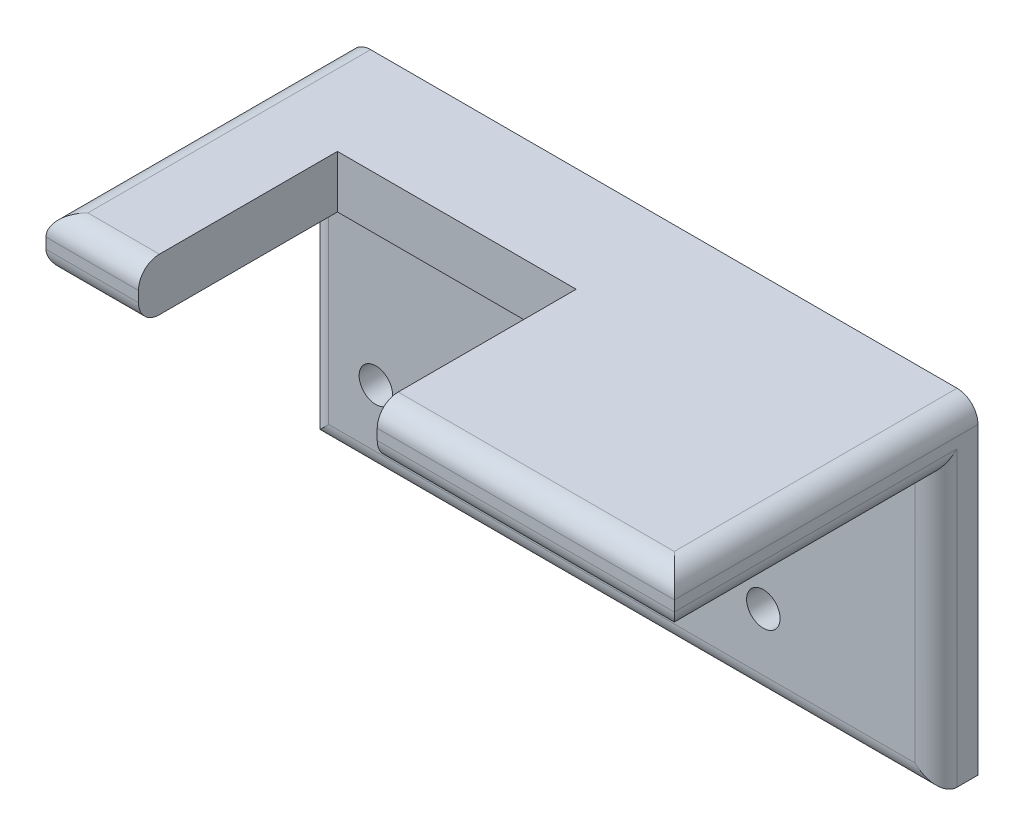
SolidWorks part; units mm, degrees
ref_plane "Plan de face" through (0, 0, 0) normal (0, 0, 1) x (1, 0, 0)
ref_plane "Plan de dessus" through (0, 0, 0) normal (0, 1, 0) x (1, 0, 0)
ref_plane "Plan de droite" through (0, 0, 0) normal (1, 0, 0) x (0, 0, -1)
sketch "Esquisse1" plane through (0, 0, 0) normal (0, 0, 1) x (1, 0, 0)
  line L0 (0, 0) -> (-59156.5526, 0) construction
  line L1 (0, 0) -> (0, 17.747) construction
  line L2 (-18.5, -36.3313) -> (-18.5, 59120.2212) construction
  line L3 (-25, 16) -> (35, 16)
  line L4 (-25, 16) -> (-25, -15)
  line L5 (-25, -15) -> (35, -15)
  line L6 (35, 16) -> (35, -15)
  line L7 (18.5, -63.5241) -> (18.5, 59093.0285) construction
  line L8 (63.747, 7.5) -> (-59092.8056, 7.5) construction
  line L9 (64.8614, -7.5) -> (-59091.6911, -7.5) construction
  line L10 (40.538, 11) -> (-33.8123, 11) construction
  circle A0 centre (-18.5, 7.5) radius 1.6
  circle A1 centre (-18.5, -7.5) radius 1.6
  circle A2 centre (0, 0) radius 1.6
  circle A3 centre (18.5, 7.5) radius 1.6
  circle A4 centre (18.5, -7.5) radius 1.6
  point P27 (0, 0)
  point P30 (0, 0)
  point P31 (0, 0)
  point P32 (0, 0)
  point P33 (0, 0)
  point P34 (0, 0)
  point P35 (0, 0)
  point P36 (0, 0)
  dimension "D5" = 11
  dimension "D1" = 18.5
  dimension "D2" = 18.5
  dimension "D3" = 7.5
  dimension "D4" = 7.5
extrude "Boss.-Extru.1" add sketch "Esquisse1" along normal blind 4
sketch "Esquisse3" plane through (0, 0, 4) normal (0, 0, 1) x (1, 0, 0)
  line L0 (0, -0.0101) -> (-41.5239, -0.0101) construction
  line L1 (0, 0) -> (0, 24.4112) construction
  line L2 (45.6968, 10.9899) -> (-41.1516, 10.9899) construction
  line L4 (-25, 16) -> (35, 16)
  line L5 (-25, 16) -> (-25, 10.9899)
  line L6 (-25, 10.9899) -> (35, 10.9899)
  line L7 (35, 16) -> (35, 10.9899)
  dimension "D1" = 11
extrude "Boss.-Extru.2" add sketch "Esquisse3" along normal blind 25
sketch3d "Esquisse3D1"
  point P0 (1.6736, 16, 8.1619)
ref_plane "SupportServo" through (0, 16, 0) normal (0, 1, 0) x (1, 0, 0)
sketch "Esquisse4" plane through (0, 16, 0) normal (0, 1, 0) x (1, 0, 0)
  line L0 (-18.5207, -35.1822) -> (-18.5207, 3.3258) construction
  line L1 (-0.0207, 0) -> (-0.0207, -36.4943) construction
  line L2 (8.9793, -41.4575) -> (8.9793, 3.8393) construction
  line L4 (-4.7707, -43.1119) -> (-4.7707, -6.943) construction
  line L5 (-16.1707, -34.8969) -> (-16.1707, -13.9029) construction
  line L6 (6.6293, -42.3703) -> (6.6293, -19.2655) construction
  line L7 (45.9036, -10) -> (-52.6197, -10) construction
  line L8 (35, 0) -> (-25, 0) construction
  line L14 (-16.1707, -10) -> (6.6293, -10)
  line L15 (-16.1707, -10) -> (-16.1707, -29)
  line L16 (-16.1707, -29) -> (6.6293, -29)
  line L17 (6.6293, -10) -> (6.6293, -29)
  line L18 (35, -29) -> (-25, -29) construction
  dimension "D1" = 18.5
  dimension "D2" = 27.5
  dimension "D3" = 13.75
  dimension "D4" = 11.4
  dimension "D5" = 11.4
  dimension "D6" = 10
extrude "Enlèv. mat.-Extru.1" cut sketch "Esquisse4" against normal up to next
fillet "Congé1" radius 2 11 edges at (-20.5853, 16, 29) (-25, 16, 14.5) (-20.5853, 10.9899, 29) (-25, 10.9899, 16.5) (-25, -2.0051, 4) (5, -15, 4) (35, -2.0051, 4) (35, 16, 14.5) (35, 10.9899, 16.5) (20.8147, 10.9899, 29) (20.8147, 16, 29)
